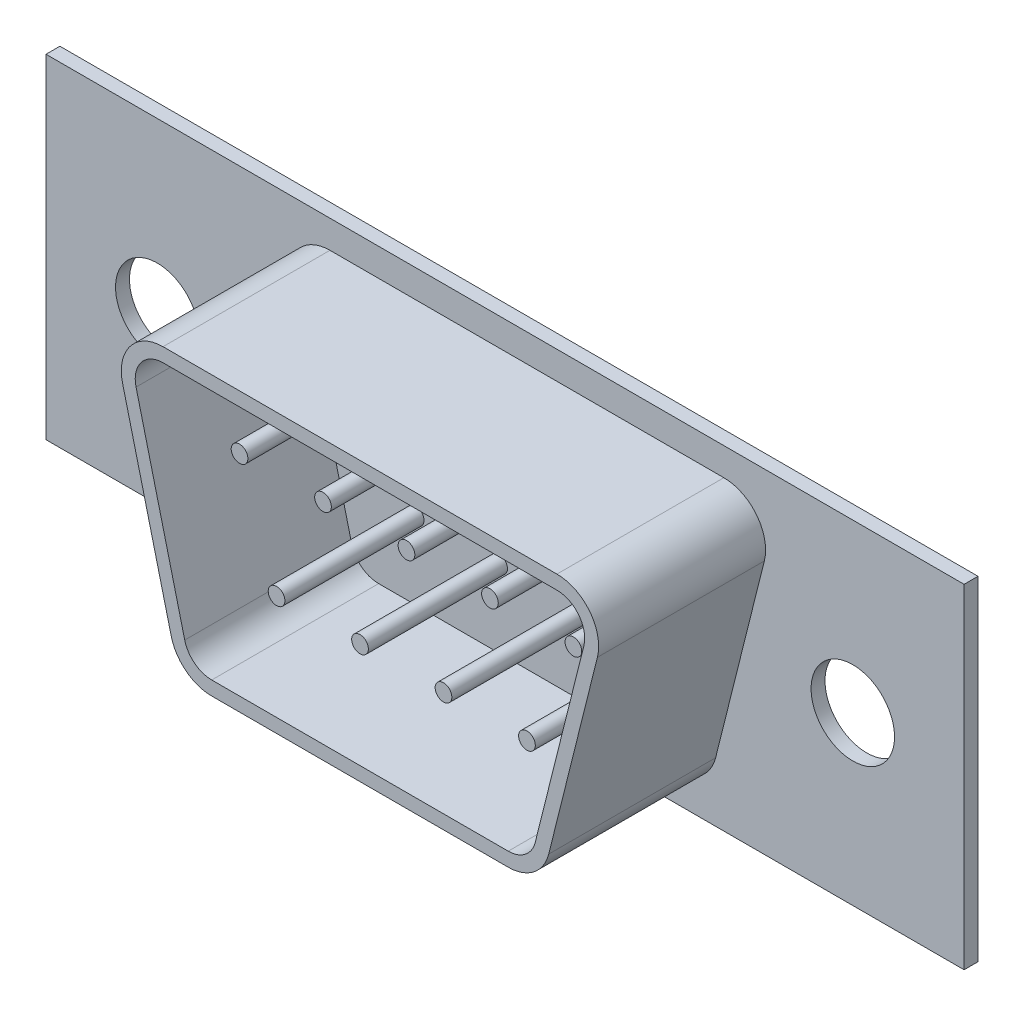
SolidWorks part; units mm, degrees
ref_plane "Face" through (0, 0, 0) normal (0, 0, 1) x (1, 0, 0)
ref_plane "Dessus" through (0, 0, 0) normal (0, 1, 0) x (1, 0, 0)
ref_plane "Droite" through (0, 0, 0) normal (1, 0, 0) x (0, 0, -1)
sketch "Esquisse1" plane through (0, 0, 0) normal (0, 0, 1) x (1, 0, 0)
  line L1 (-16.5, -6) -> (16.5, -6)
  line L2 (-16.5, -6) -> (-16.5, 6)
  line L3 (-16.5, 6) -> (16.5, 6)
  line L4 (16.5, -6) -> (16.5, 6)
  line L5 (-16.5, -6) -> (16.5, 6) construction
  line L6 (-16.5, 6) -> (16.5, -6) construction
  circle A0 centre (-12.5, 0) radius 1.5
  circle A1 centre (12.5, 0) radius 1.5
  point P0 (0, 0)
  dimension "D3" = 3
  dimension "D4" = 3
  dimension "D5" = 25
  dimension "D1" = 12
  dimension "D2" = 33
  dimension "D6" = 4
extrude "Extrusion1" add sketch "Esquisse1" along normal blind 0.5
sketch "Esquisse2" plane through (0, 0, 0.5) normal (0, 0, 1) x (1, 0, 0)
  line L0 (-8.2144, 5) -> (9.7856, 5)
  line L1 (9.7856, 5) -> (7.2856, -5)
  line L2 (7.2856, -5) -> (-5.7144, -5)
  line L3 (-5.7144, -5) -> (-8.2144, 5)
  line L4 (16.5, 6) -> (-16.5, 6) construction
  line L5 (-5.324, -4.5) -> (-7.574, 4.5)
  line L6 (-7.574, 4.5) -> (9.1453, 4.5)
  line L7 (9.1453, 4.5) -> (6.8953, -4.5)
  line L8 (6.8953, -4.5) -> (-5.324, -4.5)
  dimension "D1" = 18
  dimension "D2" = 13
  dimension "D3" = 2.5
  dimension "D4" = 10
  dimension "D5" = 1
  dimension "D6" = 0.5
extrude "Extrusion2" add sketch "Esquisse2" along normal blind 6
fillet "Congé2" radius 1 2 edges at (-7.574, 4.5, 3.5) (-5.324, -4.5, 3.5)
fillet "Congé3" radius 1 2 edges at (9.1453, 4.5, 3.5) (6.8953, -4.5, 3.5)
fillet "Congé4" radius 1.5 4 edges at (9.7856, 5, 3.5) (7.2856, -5, 3.5) (-5.7144, -5, 3.5) (-8.2144, 5, 3.5)
sketch "Esquisse3" plane through (0, 0, 0.5) normal (0, 0, 1) x (1, 0, 0)
  circle A0 centre (-4.5431, 2.0421) radius 0.3
  circle A1 centre (-1.5431, 2.0421) radius 0.3
  circle A2 centre (1.4569, 2.0421) radius 0.3
  circle A3 centre (4.4569, 2.0421) radius 0.3
  circle A4 centre (7.4569, 2.0421) radius 0.3
  circle A5 centre (-3.2123, -1.7209) radius 0.3
  circle A6 centre (-0.2123, -1.7209) radius 0.3
  circle A7 centre (2.7877, -1.7209) radius 0.3
  circle A8 centre (5.7877, -1.7209) radius 0.3
  dimension "D1" = 0.6
  dimension "D2" = 0.6
extrude "Extrusion3" add sketch "Esquisse3" along normal blind 5
